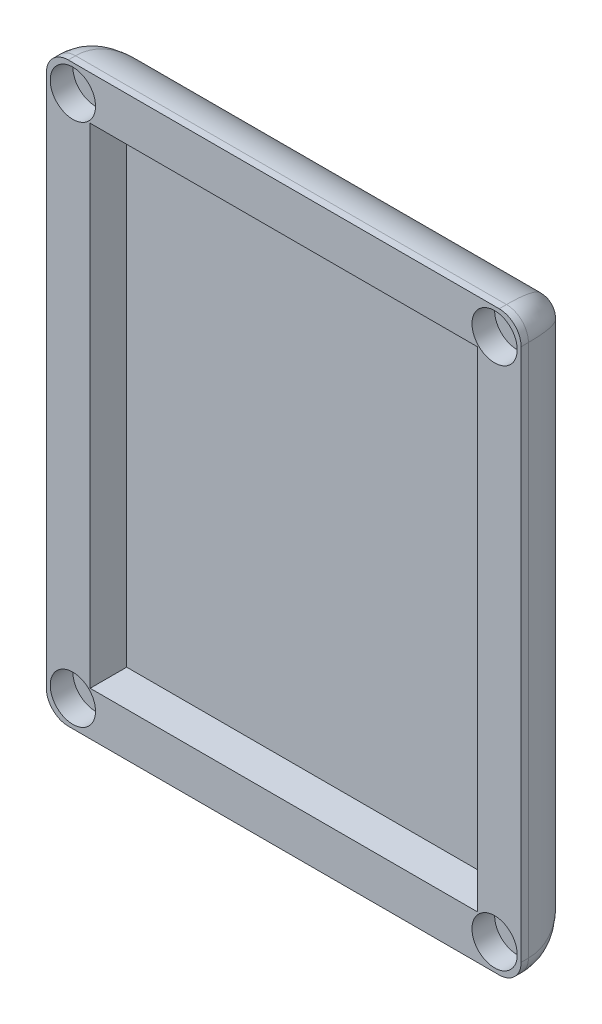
SolidWorks part; units mm, degrees
ref_plane "정면" through (0, 0, 0) normal (0, 0, 1) x (1, 0, 0)
ref_plane "윗면" through (0, 0, 0) normal (0, 1, 0) x (1, 0, 0)
ref_plane "우측면" through (0, 0, 0) normal (1, 0, 0) x (0, 0, -1)
sketch "스케치1" plane through (0, 0, 0) normal (0, 0, 1) x (1, 0, 0)
  line L1 (0, 0) -> (65, 0)
  line L2 (0, 0) -> (0, 79)
  line L3 (0, 79) -> (65, 79)
  line L4 (65, 0) -> (65, 79)
  dimension "D1" = 79
  dimension "D2" = 65
extrude "보스-돌출1" add sketch "스케치1" along normal blind 10
sketch "스케치2" plane through (0, 0, 10) normal (0, 0, 1) x (1, 0, 0)
  line L0 (32.5, 79) -> (32.5, 0) construction
  line L1 (65, 79) -> (0, 79) construction
  line L2 (0, 0) -> (65, 0) construction
  line L3 (0, 39.5) -> (65, 39.5) construction
  line L4 (0, 79) -> (0, 0) construction
  line L5 (65, 0) -> (65, 79) construction
  line L7 (6, 6) -> (59, 6)
  line L8 (6, 6) -> (6, 73)
  line L9 (6, 73) -> (59, 73)
  line L10 (59, 6) -> (59, 73)
  line L11 (32.5, 73) -> (32.5, 6) construction
  line L12 (6, 39.5) -> (59, 39.5) construction
  point P12 (32.5, 39.5)
  dimension "D1" = 67
  dimension "D2" = 53
extrude "컷-돌출1" cut sketch "스케치2" against normal blind 5
sketch "스케치3" plane through (0, 0, 10) normal (0, 0, 1) x (1, 0, 0)
  line L0 (32.5, 79) -> (32.5, 0) construction
  line L1 (65, 79) -> (0, 79) construction
  line L2 (0, 0) -> (65, 0) construction
  line L3 (0, 39.5) -> (65, 39.5) construction
  line L4 (0, 79) -> (0, 0) construction
  line L5 (65, 0) -> (65, 79) construction
  line L6 (0, 79) -> (6, 73) construction
  circle A0 centre (3.6295, 75.3705) radius 3.1
  circle A1 centre (61.3705, 75.3705) radius 3.1
  circle A2 centre (61.3705, 3.6295) radius 3.1
  circle A3 centre (3.6295, 3.6295) radius 3.1
  dimension "D1" = 6.2
extrude "컷-돌출2" cut sketch "스케치3" against normal blind 3.1 contours A3 | A2 | A1 | A0
fillet "필렛1" radius 3 4 edges at (0, 0, 5) (65, 0, 5) (65, 79, 5) (0, 79, 5)
fillet "필렛2" radius 9 8 edges at (0.8787, 0.8787, 0) (0, 39.5, 0) (0.8787, 78.1213, 0) (32.5, 79, 0) (64.1213, 78.1213, 0) (65, 39.5, 0) (64.1213, 0.8787, 0) (32.5, 0, 0)
